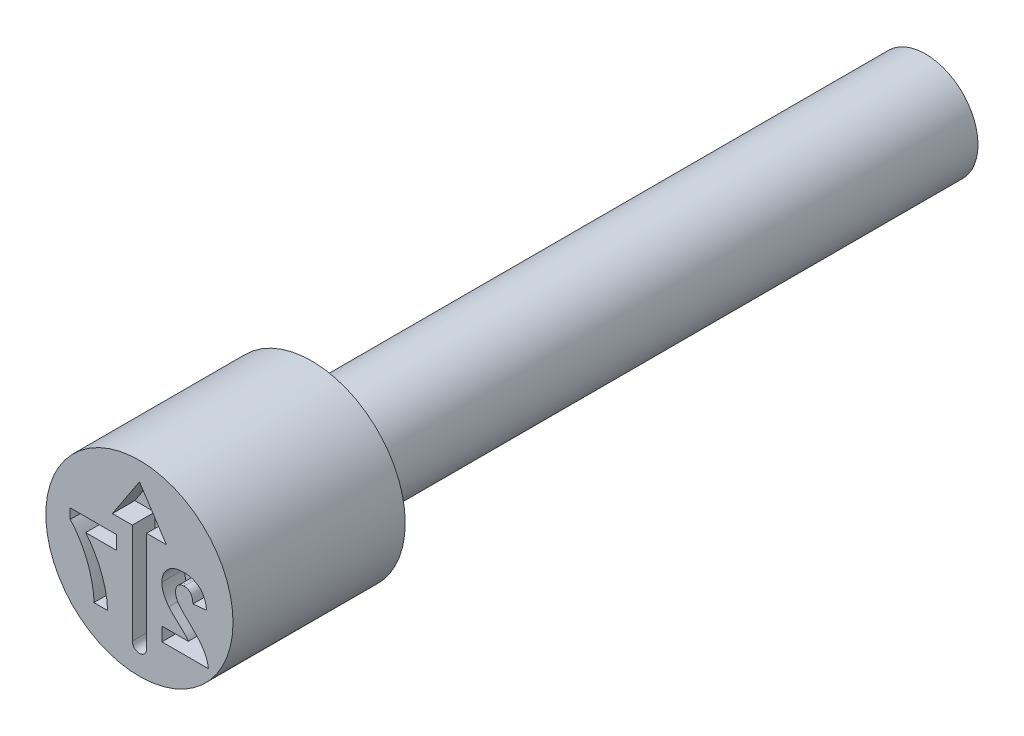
SolidWorks part; units mm, degrees
ref_plane "Front Plane" through (0, 0, 0) normal (0, 0, 1) x (1, 0, 0)
ref_plane "Top Plane" through (0, 0, 0) normal (0, 1, 0) x (1, 0, 0)
ref_plane "Right Plane" through (0, 0, 0) normal (1, 0, 0) x (0, 0, -1)
sketch "Sketch2" plane through (0, 0, 0) normal (1, 0, 0) x (0, 0, -1)
  line L0 (0.4039, 0) -> (50000.4039, 0) construction
  line L6 (0, 1.25) -> (0, 0)
  line L7 (2.3, 1.25) -> (0, 1.25)
  line L8 (2.3, 0.7) -> (2.3, 1.25)
  line L9 (10.5, 0.7) -> (2.3, 0.7)
  line L10 (10.5, 0) -> (10.5, 0.7)
  line L11 (0, 0) -> (10.5, 0)
  dimension "D1" = 2.5
  dimension "D2" = 1.4
  dimension "D3" = 10.5
  dimension "D4" = 2.3
revolve "Revolve1" add sketch "Sketch2" angle 360 about L0
sketch "Sketch3" plane through (0, 0, 0) normal (0, 0, 1) x (1, 0, 0)
  line L0 (0, 0) -> (0, 50000) construction
  line L1 (0.0952, 0.4532) -> (0.0952, -0.8881)
  line L2 (0.361, 0.4532) -> (0.0952, 0.4532)
  line L3 (0, 1.0011) -> (0.361, 0.4532)
  line L15 (0, 1.0011) -> (-0.361, 0.4532)
  line L16 (-0.361, 0.4532) -> (-0.0952, 0.4532)
  line L17 (-0.0952, 0.4532) -> (-0.0952, -0.8881)
  arc A2 (-0.0952, -0.8881) -> (0.0952, -0.8881) centre (0, -0.8881) ccw
extrude "Cut-Extrude4" cut sketch "Sketch3" against normal blind 0.3
sketch "Sketch4" plane through (0, 0, 0) normal (0, 0, 1) x (1, 0, 0)
  text T0 "2  7" font "Arial" height 0.95
  dimension "D1" = 0.7
extrude "Cut-Extrude5" cut sketch "Sketch4" against normal blind 0.3
